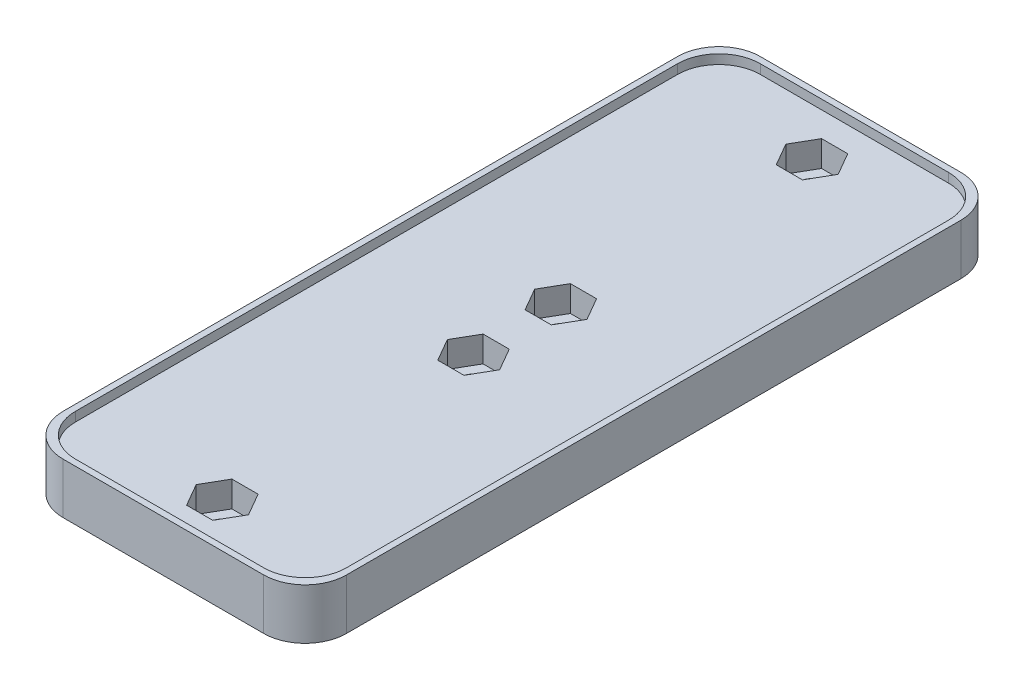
SolidWorks part; units mm, degrees
ref_plane "Front Plane" through (0, 0, 0) normal (0, 0, 1) x (1, 0, 0)
ref_plane "Top Plane" through (0, 0, 0) normal (0, 1, 0) x (1, 0, 0)
ref_plane "Right Plane" through (0, 0, 0) normal (1, 0, 0) x (0, 0, -1)
sketch "Sketch1" plane through (0, 0, 0) normal (0, 1, 0) x (1, 0, 0)
  line L0 (17.145, 5.715) -> (17.145, 36.5506) construction
  line L1 (0, 0) -> (33.02, 0)
  line L2 (0, 0) -> (0, 83.82)
  line L3 (0, 83.82) -> (33.02, 83.82)
  line L4 (33.02, 0) -> (33.02, 83.82)
  line L5 (17.145, 0) -> (17.145, 5.715) construction
  line L6 (17.145, 78.105) -> (17.145, 47.2694) construction
  line L7 (17.145, 18.6252) -> (0, 18.6252) construction
  line L8 (17.145, 70.4961) -> (0, 70.4961) construction
  line L9 (17.145, 83.82) -> (17.145, 78.105) construction
extrude "Boss-Extrude1" add sketch "Sketch1" along normal blind 5.08
sketch "Sketch2" plane through (0, 5.08, 0) normal (0, 1, 0) x (1, 0, 0)
  line L0 (17.145, 0) -> (17.145, 5.715) construction
  line L1 (17.145, 59.8372) -> (0, 59.8372) construction
  line L2 (17.145, 83.82) -> (17.145, 78.105) construction
  line L4 (17.145, 5.715) -> (17.145, 36.5506) construction
  line L5 (20.3566, 5.715) -> (18.7508, 8.4963)
  line L6 (18.7508, 8.4963) -> (15.5392, 8.4963)
  line L7 (15.5392, 8.4963) -> (13.9334, 5.715)
  line L8 (13.9334, 5.715) -> (15.5392, 2.9337)
  line L9 (15.5392, 2.9337) -> (18.7508, 2.9337)
  line L10 (18.7508, 2.9337) -> (20.3566, 5.715)
  line L11 (20.3566, 78.105) -> (18.7508, 80.8863)
  line L12 (18.7508, 80.8863) -> (15.5392, 80.8863)
  line L13 (15.5392, 80.8863) -> (13.9334, 78.105)
  line L14 (13.9334, 78.105) -> (15.5392, 75.3237)
  line L15 (15.5392, 75.3237) -> (18.7508, 75.3237)
  line L16 (18.7508, 75.3237) -> (20.3566, 78.105)
  line L17 (17.145, 78.105) -> (17.145, 47.2694) construction
  line L18 (20.3566, 36.5506) -> (18.7508, 39.3319)
  line L19 (18.7508, 39.3319) -> (15.5392, 39.3319)
  line L20 (15.5392, 39.3319) -> (13.9334, 36.5506)
  line L21 (13.9334, 36.5506) -> (15.5392, 33.7693)
  line L22 (15.5392, 33.7693) -> (18.7508, 33.7693)
  line L23 (18.7508, 33.7693) -> (20.3566, 36.5506)
  line L25 (20.3566, 47.2694) -> (18.7508, 50.0507)
  line L26 (18.7508, 50.0507) -> (15.5392, 50.0507)
  line L27 (15.5392, 50.0507) -> (13.9334, 47.2694)
  line L28 (13.9334, 47.2694) -> (15.5392, 44.4881)
  line L29 (15.5392, 44.4881) -> (18.7508, 44.4881)
  line L30 (18.7508, 44.4881) -> (20.3566, 47.2694)
  line L31 (0, 83.82) -> (0, 0) construction
  line L32 (17.145, 20.5753) -> (0, 20.5753) construction
  circle A0 centre (17.145, 5.715) radius 2.7813 construction
  circle A1 centre (17.145, 78.105) radius 2.7813 construction
  circle A2 centre (17.145, 36.5506) radius 2.7813 construction
  circle A3 centre (17.145, 47.2694) radius 2.7813 construction
extrude "Cut-Extrude1" cut sketch "Sketch2" against normal blind 3.175
sketch "Sketch4" plane through (0, 5.08, 0) normal (0, 1, 0) x (1, 0, 0)
  line L2 (15.5392, 8.4963) -> (18.7508, 2.9337) construction
  line L3 (15.5392, 75.3237) -> (18.7508, 80.8863) construction
  line L4 (15.5392, 44.4881) -> (18.7508, 50.0507) construction
  line L5 (15.5392, 33.7693) -> (18.7508, 39.3319) construction
  circle A0 centre (17.145, 5.715) radius 1.5875
  circle A1 centre (17.145, 36.5506) radius 1.5875
  circle A2 centre (17.145, 47.2694) radius 1.5875
  circle A3 centre (17.145, 78.105) radius 1.5875
extrude "Cut-Extrude2" cut sketch "Sketch4" against normal blind 7.62
sketch "Sketch6" plane through (0, 0, 0) normal (0, -1, 0) x (1, 0, 0)
  line L2 (0, 0) -> (33.02, 0)
  line L4 (0, 0) -> (0, -83.82)
  line L6 (0, -83.82) -> (33.02, -83.82)
  line L8 (33.02, 0) -> (33.02, -83.82)
  line L9 (-0.127, 0.127) -> (33.147, 0.127)
  line L10 (-0.127, 0.127) -> (-0.127, -83.947)
  line L11 (-0.127, -83.947) -> (33.147, -83.947)
  line L12 (33.147, 0.127) -> (33.147, -83.947)
extrude "Boss-Extrude2" add sketch "Sketch6" against normal blind 5.08
sketch "Sketch7" plane through (0, 0, 0) normal (0, -1, 0) x (1, 0, 0)
  line L9 (-0.889, 0.889) -> (33.909, 0.889)
  line L10 (-0.889, 0.889) -> (-0.889, -84.709)
  line L11 (-0.889, -84.709) -> (33.909, -84.709)
  line L12 (33.909, 0.889) -> (33.909, -84.709)
  line L13 (-0.127, -83.947) -> (33.147, -83.947)
  line L14 (-0.127, -83.947) -> (-0.127, 0.127)
  line L15 (-0.127, 0.127) -> (33.147, 0.127)
  line L16 (33.147, -83.947) -> (33.147, 0.127)
extrude "Boss-Extrude3" add sketch "Sketch7" against normal blind 6.223
fillet "Fillet3" radius 5.08 1 edges at (-0.127, 5.6515, -83.947)
fillet "Fillet4" radius 5.08 1 edges at (-0.889, 3.1115, -84.709)
fillet "Fillet5" radius 5.08 1 edges at (33.147, 5.6515, -83.947)
fillet "Fillet6" radius 5.08 1 edges at (33.147, 5.6515, 0.127)
fillet "Fillet7" radius 5.08 1 edges at (-0.127, 5.6515, 0.127)
fillet "Fillet8" radius 5.08 1 edges at (33.909, 3.1115, 0.889)
fillet "Fillet9" radius 5.08 1 edges at (-0.889, 3.1115, 0.889)
fillet "Fillet10" radius 5.08 1 edges at (33.909, 3.1115, -84.709)
